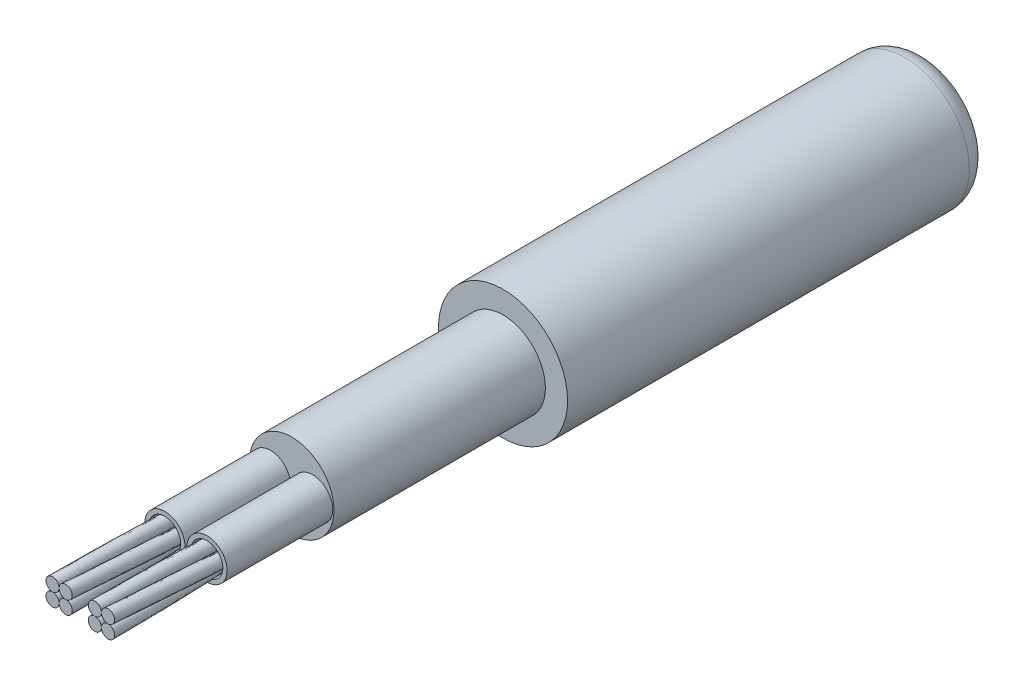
SolidWorks part; units mm, degrees
ref_plane "Alzado" through (0, 0, 0) normal (0, 0, 1) x (1, 0, 0)
ref_plane "Planta" through (0, 0, 0) normal (0, 1, 0) x (1, 0, 0)
ref_plane "Vista lateral" through (0, 0, 0) normal (1, 0, 0) x (0, 0, -1)
sketch "Croquis2" plane through (0, 0, 0) normal (0, 0, 1) x (1, 0, 0)
  circle A0 centre (0, 0) radius 3.05
  dimension "D1" = 6.1
extrude "Saliente-Extruir1" add sketch "Croquis2" along normal blind 20
fillet "Redondeo1" radius 1 1 edges at (3.05, 0, 0)
sketch "Croquis3" plane through (0, 0, 20) normal (0, 0, 1) x (1, 0, 0)
  circle A1 centre (1, 0) radius 0.75 construction
  circle A2 centre (1, 0.44) radius 0.31
  circle A3 centre (1.44, 0) radius 0.31
  circle A4 centre (1, -0.44) radius 0.31
  circle A5 centre (0.56, 0) radius 0.31
  point P16 (1, 0)
  dimension "D2" = 1.5
  dimension "D5" = 0.62
  dimension "D4" = 1
  dimension "D7" = 0.88
  dimension "D6" = 4
ref_plane "Plano1" through (1, 0, 0) normal (1, 0, 0) x (0, 0, -1)
sketch "Croquis4" plane through (1, 0, 0) normal (1, 0, 0) x (0, 0, -1)
  line L0 (-20, 0) -> (-40, 0)
  point P0 (-20, 0)
  dimension "D1" = 20
sweep "Barrer1" add profiles "Croquis3" path "Croquis4" parameters "D4"=135
sketch "Croquis6" plane through (0, 0, 20) normal (0, 0, 1) x (1, 0, 0)
  line L0 (0, 0) -> (0, 3.05) construction
  circle A0 centre (0, 0) radius 3.05 construction
  circle A1 centre (-1, 0) radius 0.75 construction
  circle A2 centre (-1, 0.44) radius 0.31
  circle A3 centre (-0.56, 0) radius 0.31
  circle A4 centre (-1, -0.44) radius 0.31
  circle A5 centre (-1.44, 0) radius 0.31
  point P18 (-1, 0)
  dimension "D2" = 1.5
  dimension "D3" = 0.62
  dimension "D1" = 1
ref_plane "Plano2" through (-1, 0, 0) normal (1, 0, 0) x (0, 0, -1)
sketch "Croquis7" plane through (-1, 0, 0) normal (1, 0, 0) x (0, 0, -1)
  line L0 (-20, 0) -> (-40, 0)
  point P0 (-20, 0)
  dimension "D1" = 20
sweep "Barrer2" add profiles "Croquis6" path "Croquis7" parameters "D4"=135
sketch "Croquis8" plane through (0, 0, 20) normal (0, 0, 1) x (1, 0, 0)
  circle A0 centre (-1, 0) radius 0.75
  circle A1 centre (0.9936, 0) radius 0.75
  dimension "D1" = 1.5
  dimension "D2" = 1.5
  dimension "D3" = 1.9936
  dimension "D4" = 1
extrude "Extruir-Lámina3" add sketch "Croquis8" along normal blind 15 separate body thin
sketch "Croquis9" plane through (0, 0, 20) normal (0, 0, 1) x (1, 0, 0)
  circle A0 centre (0, 0) radius 2
  dimension "D1" = 4
extrude "Saliente-Extruir3" add sketch "Croquis9" along normal blind 10 separate body
